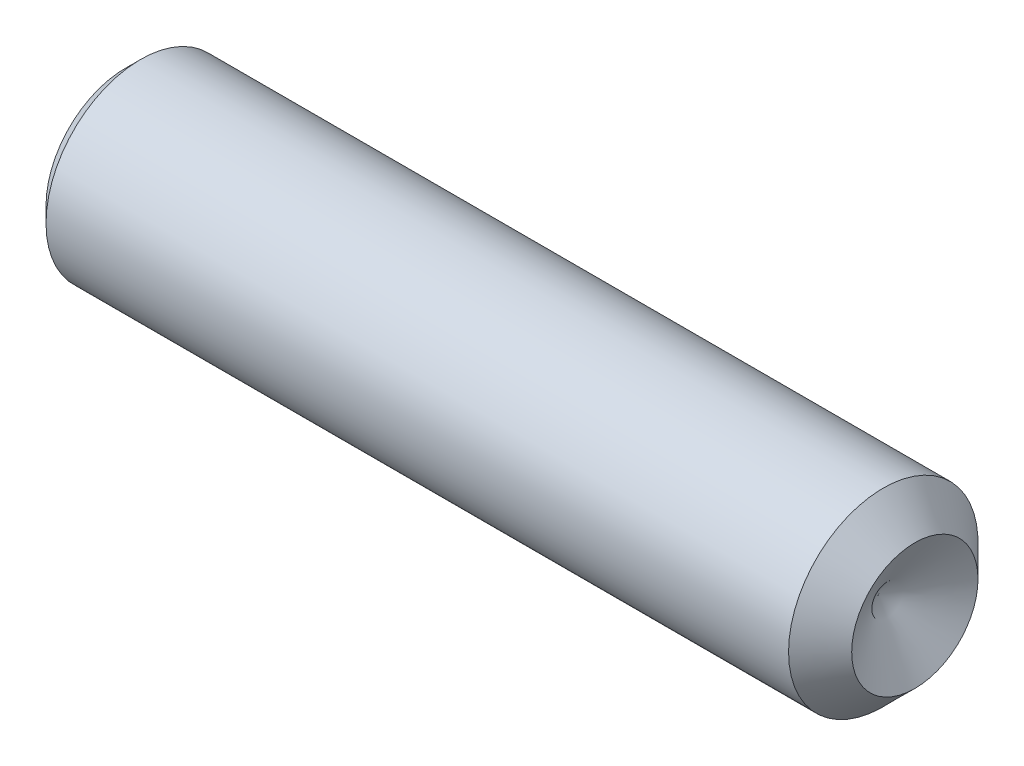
SolidWorks part; units mm, degrees
ref_plane "Front Plane" through (0, 0, 0) normal (0, 0, 1) x (1, 0, 0)
ref_plane "Top Plane" through (0, 0, 0) normal (0, 1, 0) x (1, 0, 0)
ref_plane "Right Plane" through (0, 0, 0) normal (1, 0, 0) x (0, 0, -1)
sketch "BodySke" plane through (0, 0, 0) normal (0, 0, 1) x (1, 0, 0)
  line L0 (0, 0) -> (88.3411, 0) construction
  line L1 (0, 0) -> (0, 5.036)
  line L2 (0, 5.036) -> (0.964, 6)
  line L3 (0.964, 6) -> (48, 6)
  line L4 (50, 4) -> (48, 6)
  line L6 (47.6906, 0) -> (0, 0)
  line L7 (1.75, 0) -> (1.75, 8.5388) construction
  line L8 (0, -5.036) -> (0.964, -6) construction
  line L9 (50, 4) -> (47.6906, 0)
  line L10 (50, -4) -> (47.6906, 0) construction
  dimension "Diameter" = 12
  dimension "Thread_minor" = 10.072
  dimension "Length" = 50
  dimension "Cup_dia" = 8
  dimension "Nose_chamfer_angle" = 45
  dimension "Drive_chamfer_angle" = 90
  dimension "Advance" = 1.75
  dimension "Cup_angle" = 120
revolve "BaseBody" add sketch "BodySke" angle 360 about L0
sketch "CountersinkSke" plane through (0, 0, 0) normal (1, 0, 0) x (0, 0, -1)
  line L1 (0, 3.4641) -> (-3, 1.7321)
  line L2 (-3, 1.7321) -> (-3, -1.7321)
  line L3 (-3, -1.7321) -> (0, -3.4641)
  line L4 (0, -3.4641) -> (3, -1.7321)
  line L5 (3, -1.7321) -> (3, 1.7321)
  line L6 (3, 1.7321) -> (0, 3.4641)
  circle A0 centre (0, 0) radius 3 construction
  dimension "Countersink_width" = 6
extrude "Countersink" cut sketch "CountersinkSke" along normal blind 8
sketch "ThdSchSke" plane through (0, 0, 0) normal (0, 0, 1) x (1, 0, 0)
  line L0 (0, 0) -> (53.6961, 0) construction
  line L1 (1.6009, 7.1131) -> (1.6009, 6)
  line L2 (1.6009, 7.1131) -> (2.714, 7.1131)
  line L3 (2.714, 7.1131) -> (2.714, 6)
  line L4 (2.714, 6) -> (2.1574, 5.036)
  line L5 (2.1574, 5.036) -> (1.6009, 6)
  dimension "D1" = 1.75
revolve "ThreadSchematic" [suppressed] cut sketch "ThdSchSke" angle 360 about L0
pattern_linear "ThdSchPat" [suppressed]
equation "\"Thread_minor@ThreadCosmetic\" = \"Thread_minor@BodySke\""
equation "\"D1@ThdSchSke\" = \"Advance@BodySke\""
equation "\"Advance@ThdSchPat\" = \"Advance@BodySke\""
equation "\"Tooth_Num@ThdSchPat\" =  int( \"Length@BodySke\" / \"Advance@BodySke\" )  - 1"
